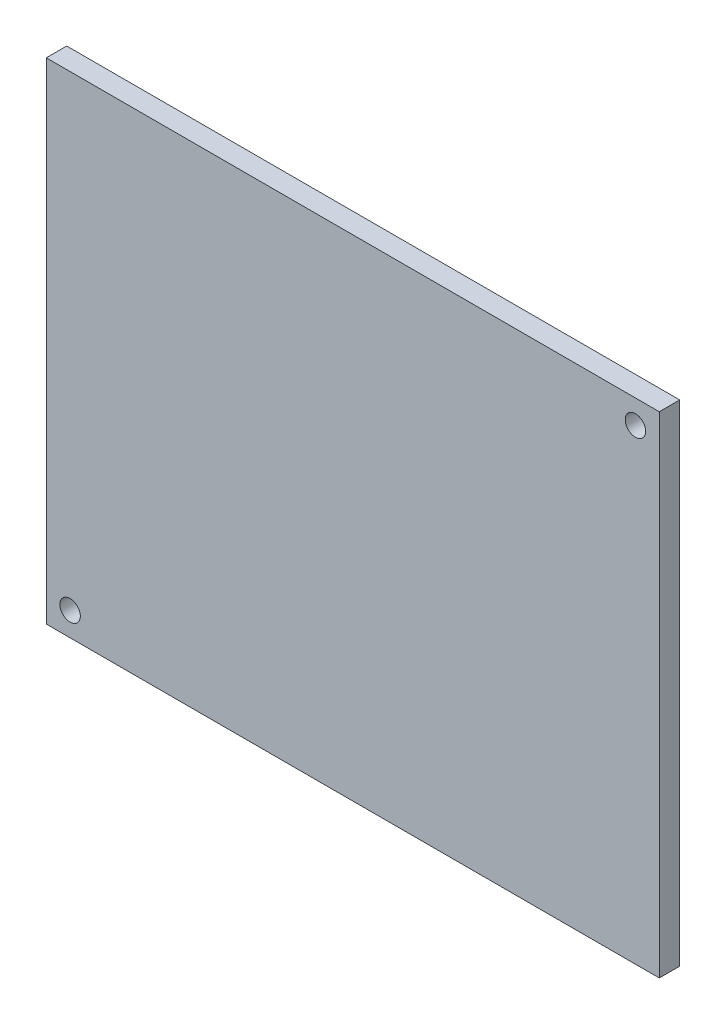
SolidWorks part; units mm, degrees
ref_plane "Alzado" through (0, 0, 0) normal (0, 0, 1) x (1, 0, 0)
ref_plane "Planta" through (0, 0, 0) normal (0, 1, 0) x (1, 0, 0)
ref_plane "Vista lateral" through (0, 0, 0) normal (1, 0, 0) x (0, 0, -1)
sketch "Croquis1" plane through (0, 0, 0) normal (0, 0, 1) x (1, 0, 0)
  line L5 (-45, -36) -> (45, -36)
  line L6 (-45, -36) -> (-45, 36)
  line L19 (-45, 36) -> (45, 36)
  line L24 (45, -36) -> (45, 36)
  line L25 (-45, -36) -> (45, 36) construction
  line L26 (-45, 36) -> (45, -36) construction
  point P0 (0, 0)
  dimension "D1" = 90
  dimension "D2" = 72
extrude "Saliente-Extruir2" add sketch "Croquis1" against normal blind 3
sketch "Croquis2" plane through (0, 0, 0) normal (0, 0, 1) x (1, 0, 0)
  line L4 (-45, -36) -> (45, -36)
  line L5 (45, -36) -> (45, 36)
  line L6 (45, 36) -> (-45, 36)
  line L7 (-45, 36) -> (-45, -36)
  line L8 (-45, -36) -> (45, -36)
  line L9 (45, -36) -> (45, 36)
  line L10 (45, 36) -> (-45, 36)
  line L11 (-45, 36) -> (-45, -36)
  circle A0 centre (-41.5, -32.5) radius 1.5 construction
  circle A1 centre (41.5, 32.5) radius 1.5 construction
  circle A2 centre (-41.5, -32.5) radius 1.5
  circle A3 centre (41.5, 32.5) radius 1.5
  dimension "D1" = 0
extrude "Cortar-Extruir1" cut sketch "Croquis2" against normal through all flip side to cut
